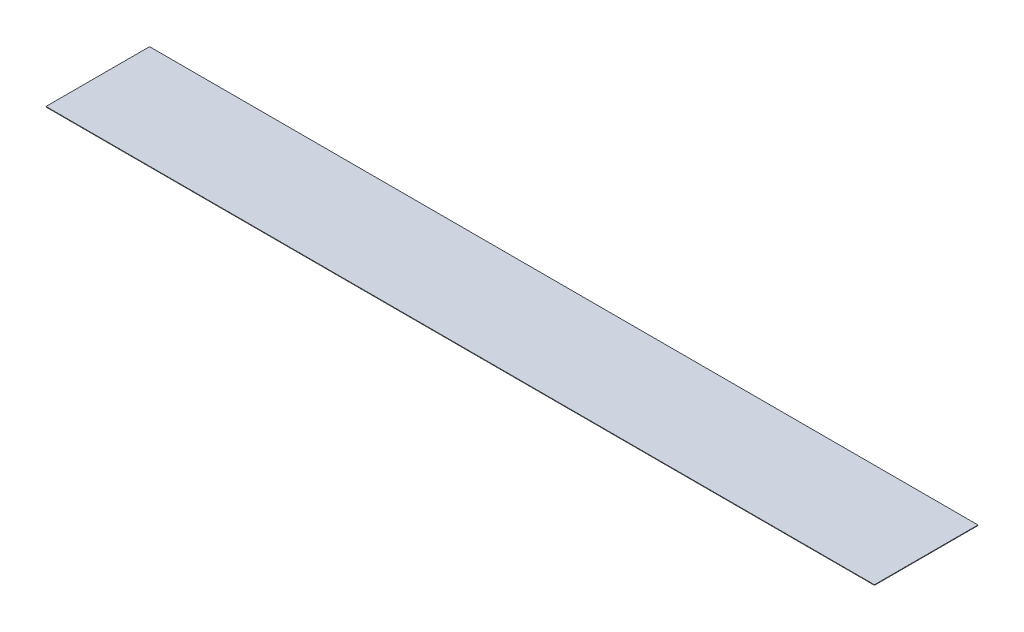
SolidWorks part; units mm, degrees
ref_plane "Front Plane" through (0, 0, 0) normal (0, 0, 1) x (1, 0, 0)
ref_plane "Top Plane" through (0, 0, 0) normal (0, 1, 0) x (1, 0, 0)
ref_plane "Right Plane" through (0, 0, 0) normal (1, 0, 0) x (0, 0, -1)
sketch "Sketch1" plane through (0, 0, 0) normal (0, 1, 0) x (1, 0, 0)
  line L1 (-203.2, -25.4) -> (203.2, -25.4)
  line L2 (-203.2, -25.4) -> (-203.2, 25.4)
  line L3 (-203.2, 25.4) -> (203.2, 25.4)
  line L4 (203.2, -25.4) -> (203.2, 25.4)
  line L5 (-203.2, -25.4) -> (203.2, 25.4) construction
  line L6 (-203.2, 25.4) -> (203.2, -25.4) construction
  point P0 (0, 0)
  dimension "D1" = 50.8
  dimension "D2" = 406.4
extrude "Boss-Extrude1" add sketch "Sketch1" along normal blind 0.254
